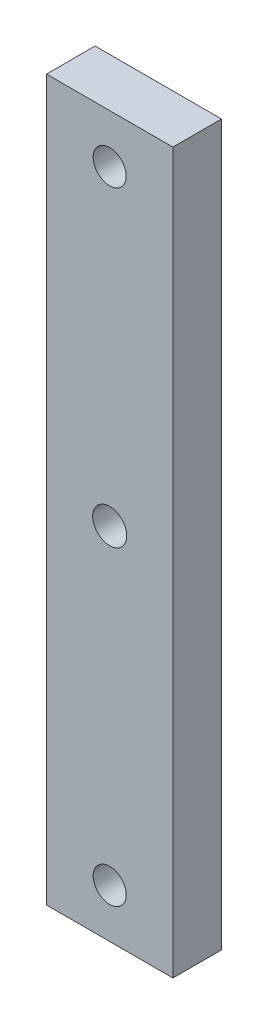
SolidWorks part; units mm, degrees
ref_plane "Plan de face" through (0, 0, 0) normal (0, 0, 1) x (1, 0, 0)
ref_plane "Plan de dessus" through (0, 0, 0) normal (0, 1, 0) x (1, 0, 0)
ref_plane "Plan de droite" through (0, 0, 0) normal (1, 0, 0) x (0, 0, -1)
sketch "Esquisse1" plane through (0, 0, 0) normal (0, 0, 1) x (1, 0, 0)
  line L1 (870, 55) -> (805, 55)
  line L2 (870, 55) -> (870, -315)
  line L4 (805, 55) -> (805, -315)
  line L5 (805, -315) -> (870, -315)
  dimension "D1" = 65
extrude "Extrusion1" add sketch "Esquisse1" along normal blind 25
sketch "Esquisse3" plane through (0, 0, 25) normal (0, 0, 1) x (1, 0, 0)
  line L0 (870, -315) -> (870, 55) construction
  line L1 (870, 55) -> (805, 55) construction
  line L2 (805, 55) -> (805, -315) construction
  line L4 (805, -315) -> (870, -315) construction
  circle A0 centre (837.5, 30) radius 8.5
  circle A1 centre (837.5, -290) radius 8.5
  dimension "D1" = 17
  dimension "D2" = 32.5
  dimension "D3" = 25
  dimension "D4" = 17
  dimension "D5" = 32.5
  dimension "D6" = 25
extrude "Enlèv. mat.-Extru.1" cut sketch "Esquisse3" against normal through all
sketch "Esquisse6" plane through (0, 0, 25) normal (0, 0, 1) x (1, 0, 0)
  line L0 (870, -315) -> (870, 55) construction
  line L1 (870, 55) -> (805, 55) construction
  circle A0 centre (837.5, -130) radius 8.75
  dimension "D1" = 17.5
  dimension "D2" = 32.5
  dimension "D3" = 185
extrude "Enlèv. mat.-Extru.2" cut sketch "Esquisse6" against normal through all
